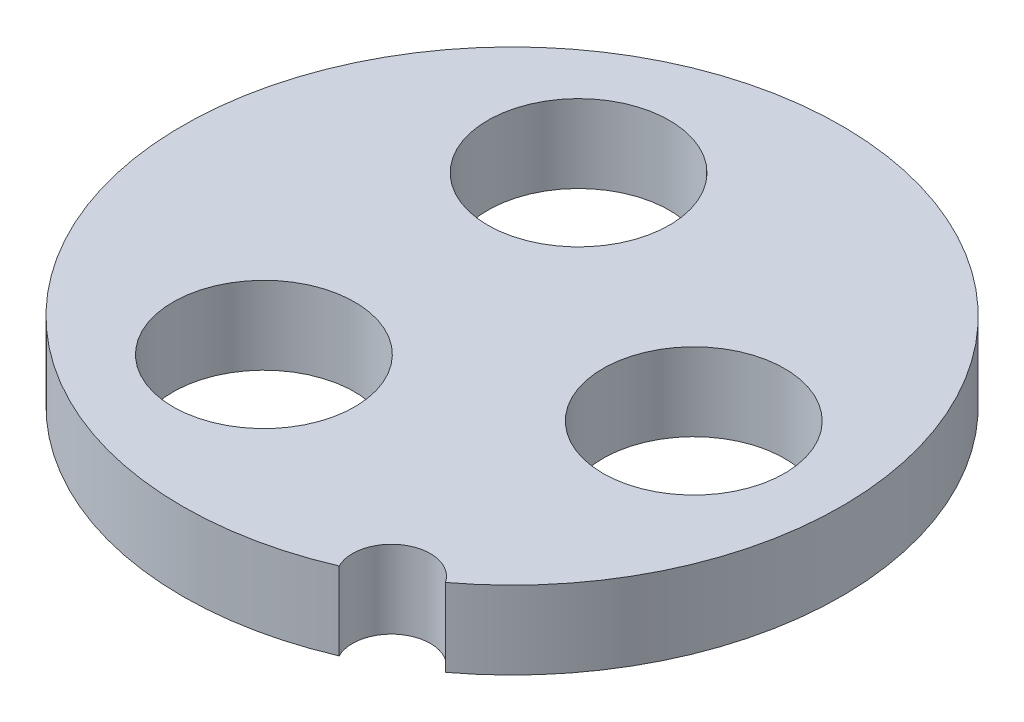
SolidWorks part; units mm, degrees
ref_plane "Plan de face" through (0, 0, 0) normal (0, 0, 1) x (1, 0, 0)
ref_plane "Plan de dessus" through (0, 0, 0) normal (0, 1, 0) x (1, 0, 0)
ref_plane "Plan de droite" through (0, 0, 0) normal (1, 0, 0) x (0, 0, -1)
sketch "Esquisse1" plane through (0, 0, 0) normal (0, 1, 0) x (1, 0, 0)
  circle A0 centre (0, 0) radius 3.5 construction
  circle A1 centre (3.5, 0) radius 1.75
  circle A2 centre (-1.75, -3.0311) radius 1.75
  circle A3 centre (-1.75, 3.0311) radius 1.75
  circle A4 centre (0, 0) radius 6.35
  dimension "D1" = 7
  dimension "D2" = 12.7
  dimension "D3" = 3.5
extrude "Extrusion1" add sketch "Esquisse1" along normal blind 1.5
sketch "Esquisse2" plane through (0, 0, 0) normal (0, -1, 0) x (1, 0, 0)
  line L0 (0, 0) -> (7.5353, 13.0515) construction
  line L1 (0, 0) -> (0, 10.0128) construction
  circle A0 centre (3.175, 5.4993) radius 0.75
  circle A1 centre (0, 0) radius 6.35 construction
  dimension "D2" = 1.5
  dimension "D1" = 30
extrude "Enlèv. mat.-Extru.1" cut sketch "Esquisse2" against normal through all
